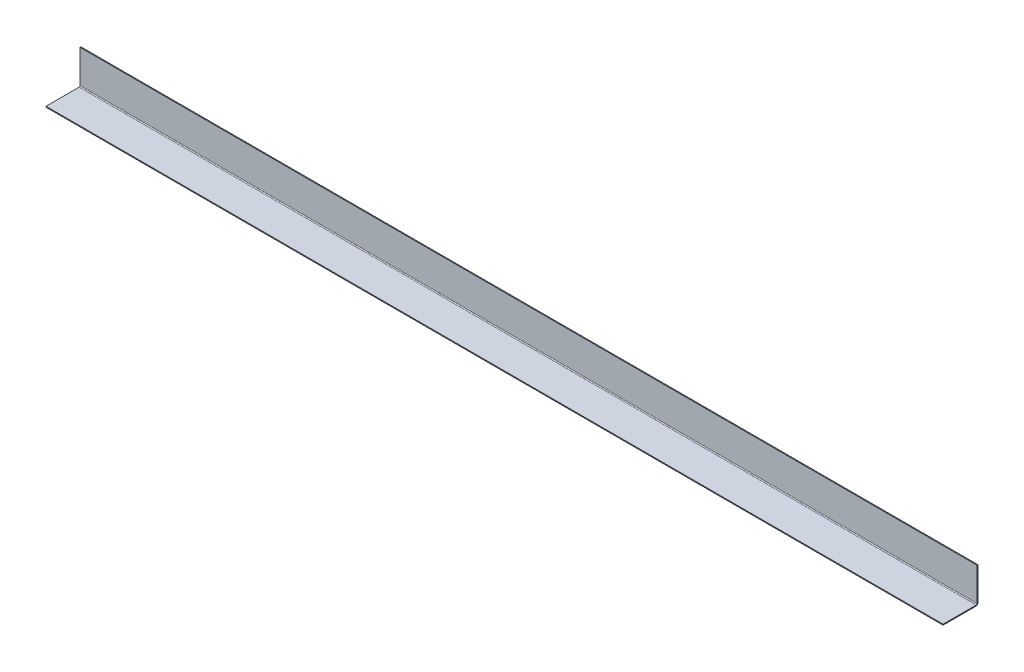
SolidWorks part; units mm, degrees
ref_plane "Front Plane" through (0, 0, 0) normal (0, 0, 1) x (1, 0, 0)
ref_plane "Top Plane" through (0, 0, 0) normal (0, 1, 0) x (1, 0, 0)
ref_plane "Right Plane" through (0, 0, 0) normal (1, 0, 0) x (0, 0, -1)
sketch "Sketch1" plane through (0, 0, 0) normal (0, 0, 1) x (1, 0, 0)
  line L1 (-1000, 76.2) -> (1000, 76.2)
  line L2 (-1000, 76.2) -> (-1000, -76.2)
  line L3 (-1000, -76.2) -> (1000, -76.2)
  line L4 (1000, 76.2) -> (1000, -76.2)
  line L5 (-1000, 76.2) -> (1000, -76.2) construction
  line L6 (-1000, -76.2) -> (1000, 76.2) construction
  point P0 (0, 0)
  dimension "D1" = 152.4
  dimension "D2" = 2000
sheet metal parameters "Sheet-Metal1" thickness 2 parameters "D1"=2
base flange "Base-Flange1" sketch "Sketch1" thickness 2 reverse thickness direction yes parameters "D1"=2
sketch "Sketch3" plane through (0, 0, 2) normal (0, 0, 1) x (1, 0, 0)
  line L0 (-1000, 0) -> (1000, 0)
  line L1 (-1000, 76.2) -> (-1000, -76.2) construction
  line L2 (1000, -76.2) -> (1000, 76.2) construction
  line L3 (-1000, -76.2) -> (1000, -76.2) construction
  dimension "D1" = 76.2
sketched bend "Sketched Bend1" parameters "D1"=0.7366
bend "SketchBend1" bend radius 2 bend angle 90 parameters "D5"=1
flat pattern "Flat-Pattern1"
sketch "Bend-Lines1" plane through (0, 0, 0) normal (0, 1, 0) x (-1, 0, 0)
bend of the flat pattern "Flatten-<SketchBend1>1"
